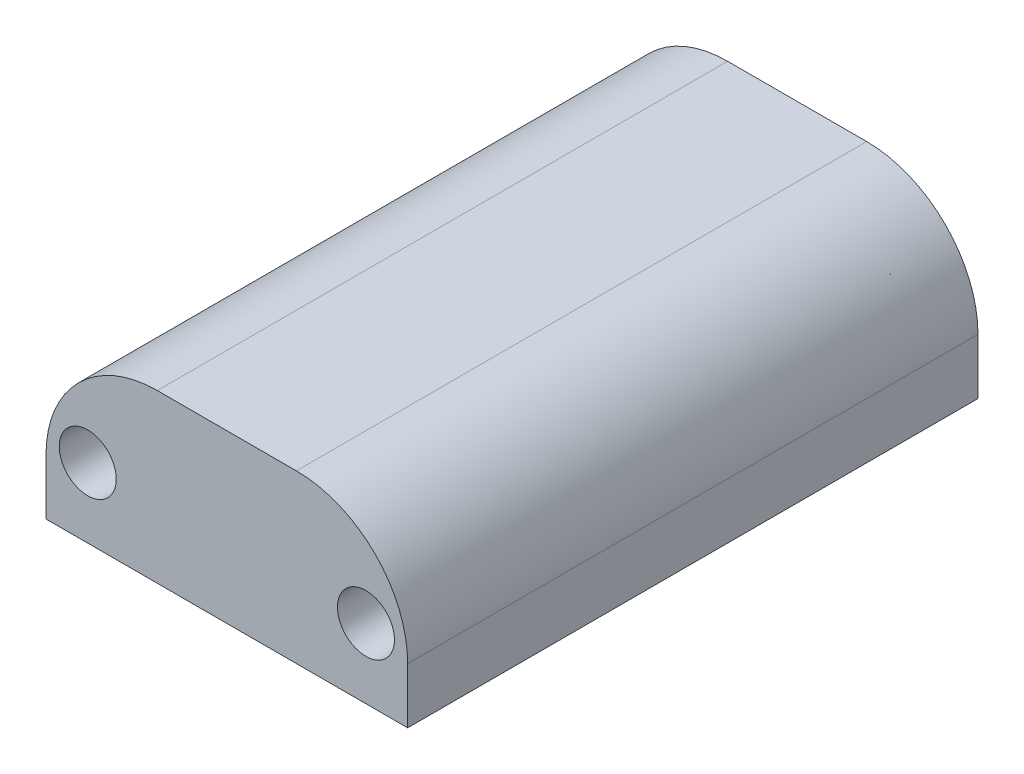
SolidWorks part; units mm, degrees
ref_plane "前视基准面" through (0, 0, 0) normal (0, 0, 1) x (1, 0, 0)
ref_plane "上视基准面" through (0, 0, 0) normal (0, 1, 0) x (1, 0, 0)
ref_plane "右视基准面" through (0, 0, 0) normal (1, 0, 0) x (0, 0, -1)
sketch "草图1" plane through (0, 0, 0) normal (0, 0, 1) x (1, 0, 0)
  line L1 (-13, -6) -> (13, -6)
  line L2 (-13, -6) -> (-13, 6)
  line L3 (-13, 6) -> (13, 6)
  line L4 (13, -6) -> (13, 6)
  line L5 (-13, -6) -> (13, 6) construction
  line L6 (-13, 6) -> (13, -6) construction
  point P0 (0, 0)
  dimension "D1" = 26
  dimension "D2" = 12
extrude "凸台-拉伸1" add sketch "草图1" along normal mid plane 41
sketch "草图2" plane through (0, 0, 20.5) normal (0, 0, 1) x (1, 0, 0)
  line L0 (-18.6083, -1) -> (24.0834, -1) construction
  line L1 (-13, -6) -> (13, -6) construction
  circle A0 centre (-10, -1) radius 2.05
  circle A1 centre (10, -1) radius 2.05
  point P4 (-10, -1)
  point P5 (10, -1)
  dimension "D4" = 4.1
  dimension "D5" = 4.1
  dimension "D1" = 5
  dimension "D2" = 10
  dimension "D3" = 10
fillet "圆角1" radius 8 2 edges at (-13, 6, 0) (13, 6, 0)
extrude "切除-拉伸1" cut sketch "草图2" against normal up to surface (41 mm away)
